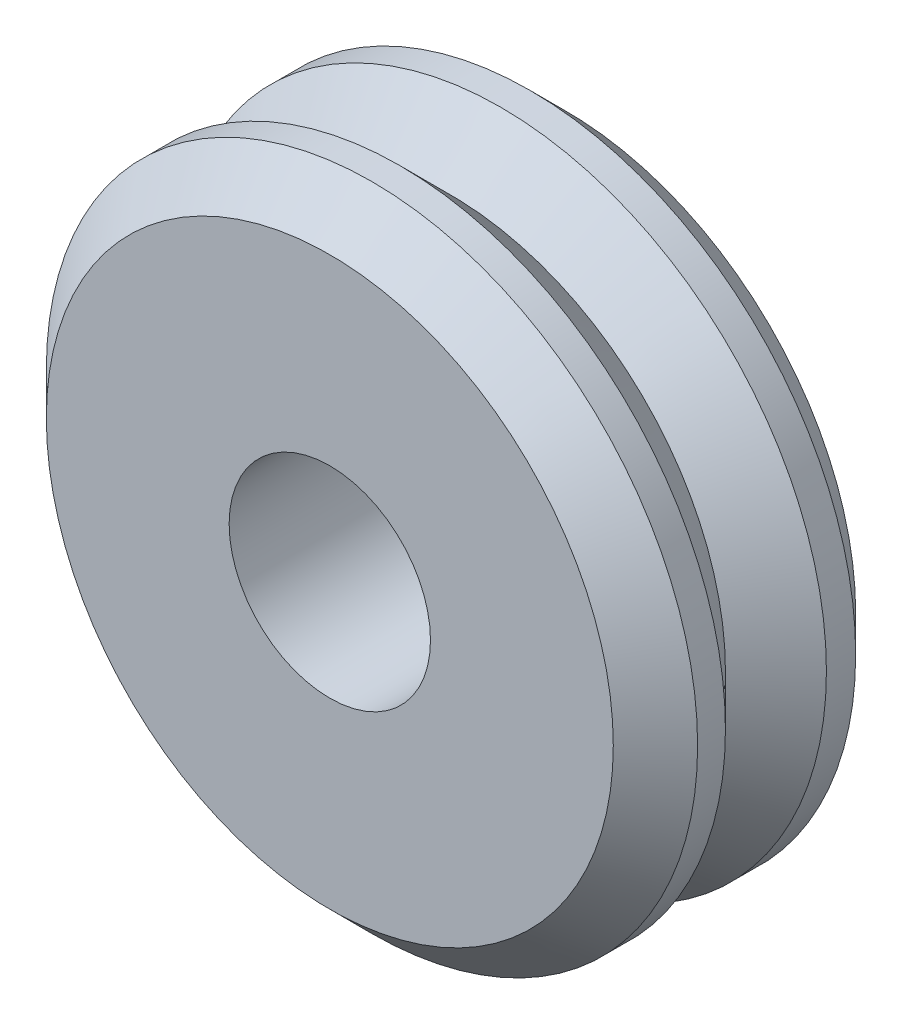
SolidWorks part; units mm, degrees
ref_plane "Plan de face" through (0, 0, 0) normal (0, 0, 1) x (1, 0, 0)
ref_plane "Plan de dessus" through (0, 0, 0) normal (0, 1, 0) x (1, 0, 0)
ref_plane "Plan de droite" through (0, 0, 0) normal (1, 0, 0) x (0, 0, -1)
sketch "Esquisse1" plane through (0, 0, 0) normal (0, 0, 1) x (1, 0, 0)
  circle A0 centre (0, 0) radius 15.365
  circle A1 centre (0, 0) radius 4.75
  dimension "D1" = 30.73
  dimension "D2" = 9.5
extrude "Boss.-Extru.1" add sketch "Esquisse1" along normal blind 11.13
sketch "Esquisse2" plane through (0, 0, 0) normal (1, 0, 0) x (0, 0, -1)
  line L0 (-11.5228, 12.9827) -> (-8.4844, 16.0211)
  line L1 (-11.5228, 17.9325) -> (-11.5228, 12.9827)
  line L2 (-8.4844, 16.0211) -> (-5.446, 12.9827)
  line L3 (-5.446, 12.9827) -> (-2.3735, 16.0551)
  line L4 (-2.3735, 16.0551) -> (0.6989, 12.9827)
  line L5 (0.6989, 12.9827) -> (0.6989, 17.9325)
  line L6 (0.6989, 17.9325) -> (-11.5228, 17.9325)
  dimension "D1" = 45
revolve "Enlèvement de matière-Révolution1" cut sketch "Esquisse2" angle 360 about axis through (0, 0, 11.13) along (0, 0, -1)
